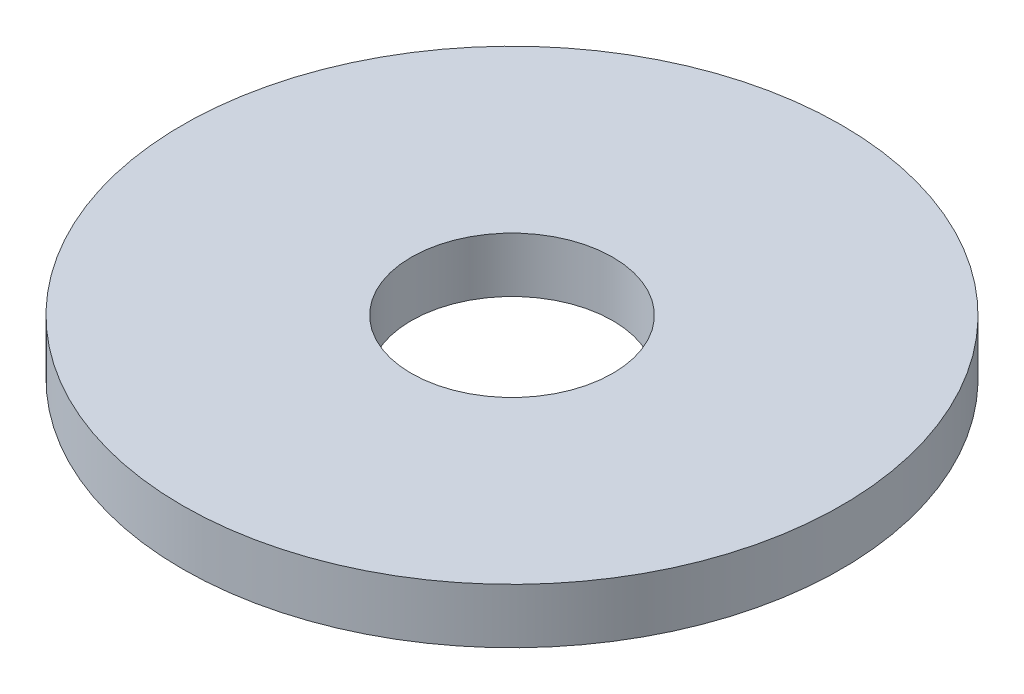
SolidWorks part; units mm, degrees
ref_plane "Plane1" through (0, 0, 0) normal (0, 0, 1) x (1, 0, 0)
ref_plane "Plane2" through (0, 0, 0) normal (0, 1, 0) x (1, 0, 0)
ref_plane "Plane3" through (0, 0, 0) normal (1, 0, 0) x (0, 0, -1)
sketch "Sketch1" plane through (0, 0, 0) normal (0, 1, 0) x (1, 0, 0)
  circle A0 centre (0, 0) radius 36
  dimension "OutsideDia" = 72
extrude "Base-Extrude" add sketch "Sketch1" against normal blind 6
sketch "Sketch2" plane through (0, 0, 0) normal (0, 1, 0) x (-1, 0, 0)
  circle A0 centre (0, 0) radius 11
  dimension "HoleDia" = 22
extrude "Type-R" cut sketch "Sketch2" against normal through all
sketch "Sketch3" plane through (0, 0, 0) normal (0, 1, 0) x (-1, 0, 0)
  line L1 (11, 11) -> (-11, 11)
  line L2 (11, 11) -> (11, -11)
  line L3 (11, -11) -> (-11, -11)
  line L4 (-11, 11) -> (-11, -11)
  dimension "D1" = 22
  dimension "SquareSize" = 22
  dimension "D2" = 11
  dimension "D3" = 11
extrude "Type-V" [suppressed] cut sketch "Sketch3" against normal through all
equation "\"D1@Sketch3\" = \"SquareSize@Sketch3\""
equation "\"D2@Sketch3\" = \"SquareSize@Sketch3\" / 2"
equation "\"D3@Sketch3\" = \"D1@Sketch3\" / 2"
